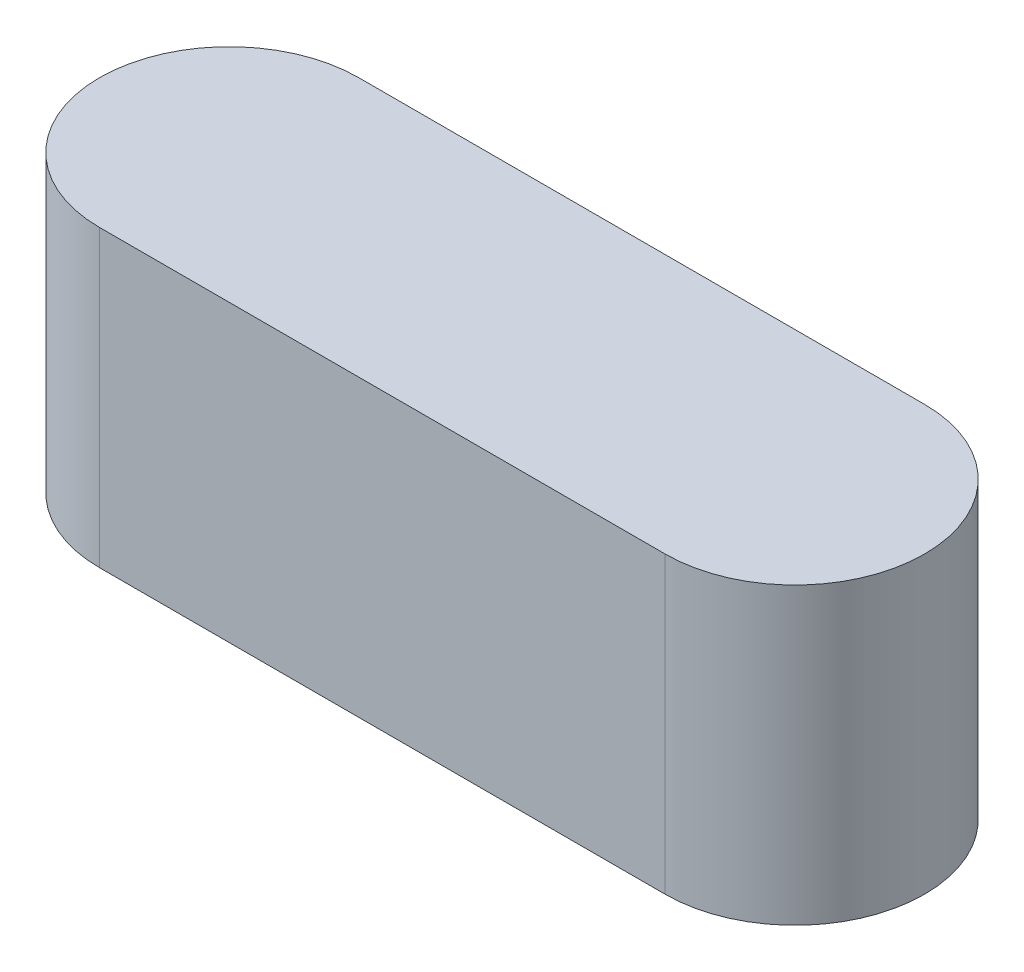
SolidWorks part; units mm, degrees
ref_plane "前视基准面" through (0, 0, 0) normal (0, 0, 1) x (1, 0, 0)
ref_plane "上视基准面" through (0, 0, 0) normal (0, 1, 0) x (1, 0, 0)
ref_plane "右视基准面" through (0, 0, 0) normal (1, 0, 0) x (0, 0, -1)
sketch "Sketch2" plane through (0, 0, 0) normal (0, 1, 0) x (1, 0, 0)
  line L0 (-40.5364, 0) -> (49.6296, 0) construction
  line L1 (-24, 26) -> (24, 26) construction
  line L2 (24, -26) -> (-24, -26) construction
  line L3 (0, 21.7114) -> (0, -32.6948) construction
  line L4 (24, -11) -> (-24, -11)
  line L5 (-24, 11) -> (24, 11)
  arc A0 (24, 26) -> (24, -26) centre (24, 0) cw construction
  arc A1 (-24, -26) -> (-24, 26) centre (-24, 0) cw construction
  arc A2 (-24, -11) -> (-24, 11) centre (-24, 0) cw
  arc A3 (24, 11) -> (24, -11) centre (24, 0) cw
  dimension "D2" = 26
  dimension "D1" = 48
  dimension "D3" = 15
extrude "拉伸1" add sketch "Sketch2" along normal blind 25
